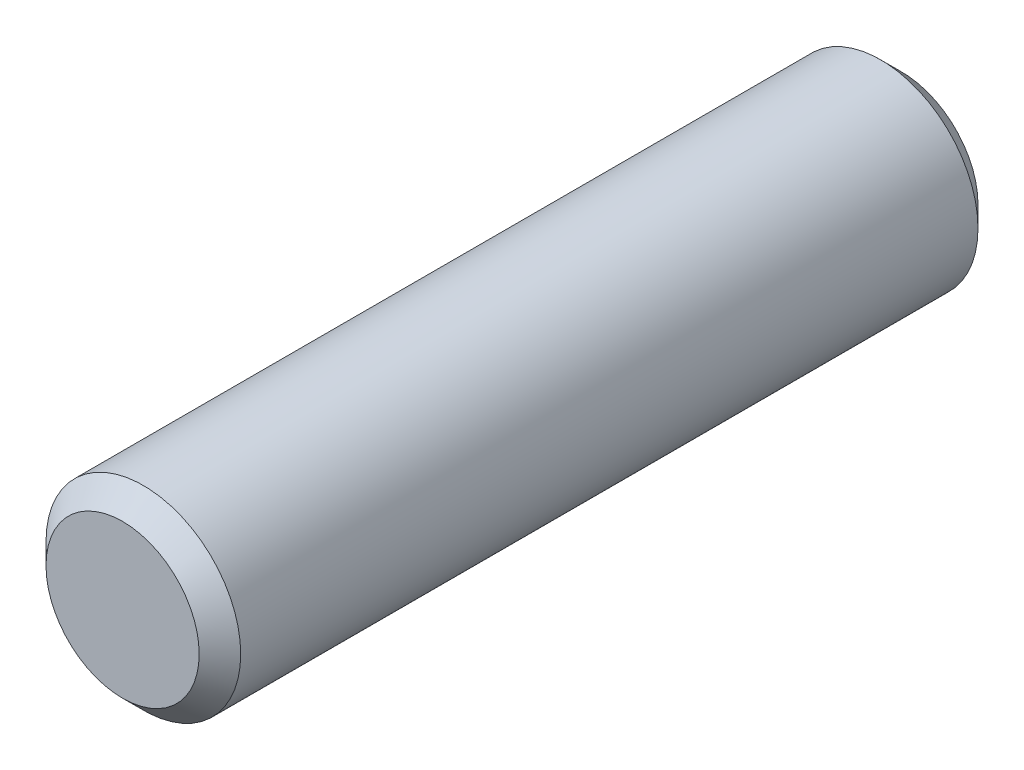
SolidWorks part; units mm, degrees
ref_plane "Front Plane" through (0, 0, 0) normal (0, 0, 1) x (1, 0, 0)
ref_plane "Top Plane" through (0, 0, 0) normal (0, 1, 0) x (1, 0, 0)
ref_plane "Right Plane" through (0, 0, 0) normal (1, 0, 0) x (0, 0, -1)
sketch "Sketch1" plane through (0, 0, 0) normal (0, 0, 1) x (1, 0, 0)
  circle A0 centre (0, 0) radius 2.3813
  dimension "D1" = 4.7625
extrude "Extrude1" add sketch "Sketch1" along normal mid plane 19.05
chamfer "Chamfer1" distance 0.508 angle 45 2 edges at (2.3813, 0, -9.525) (2.3813, 0, 9.525)
